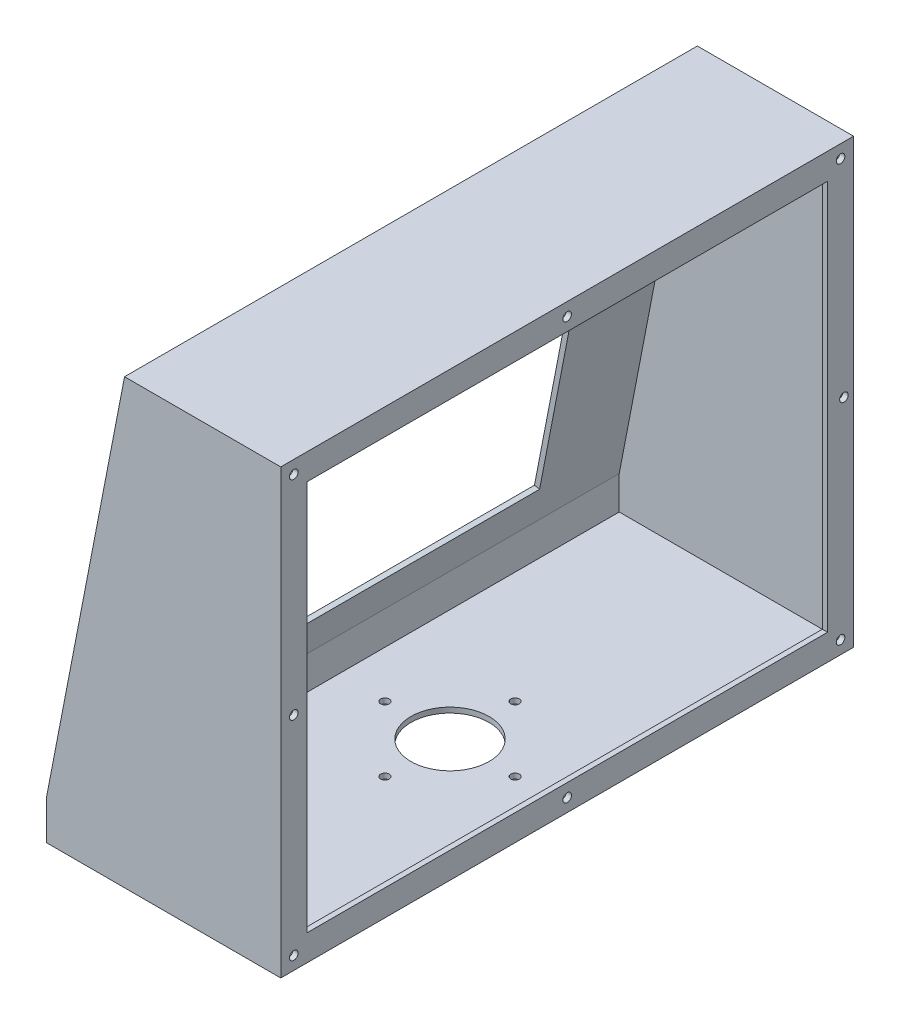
SolidWorks part; units mm, degrees
ref_plane "前基準面" through (0, 0, 0) normal (0, 0, 1) x (1, 0, 0)
ref_plane "上基準面" through (0, 0, 0) normal (0, 1, 0) x (1, 0, 0)
ref_plane "右基準面" through (0, 0, 0) normal (1, 0, 0) x (0, 0, -1)
sketch "草圖1" plane through (0, 0, 0) normal (0, 0, 1) x (1, 0, 0)
  line L0 (0, 0) -> (-30, -155)
  line L1 (-30, -155) -> (-30, -170)
  line L2 (-30, -170) -> (60, -170)
  line L3 (60, -170) -> (60, 0)
  line L4 (60, 0) -> (0, 0)
  dimension "D1" = 170
  dimension "D2" = 90
  dimension "D3" = 60
  dimension "D4" = 15
extrude "填料-伸長1" add sketch "草圖1" along normal blind 220
sketch "草圖3" plane through (60, 0, 0) normal (1, 0, 0) x (0, 0, -1)
  line L0 (-220, -170) -> (-220, 0) construction
  line L1 (-210, -10) -> (-10, -10)
  line L2 (-210, -10) -> (-210, -160)
  line L3 (-210, -160) -> (-10, -160)
  line L4 (-10, -10) -> (-10, -160)
  line L5 (-220, -170) -> (0, -170) construction
  dimension "D1" = 200
  dimension "D2" = 10
  dimension "D3" = 150
  dimension "D4" = 10
extrude "除料-伸長3" cut sketch "草圖3" against normal blind 60
shell "薄殼2" thickness 2
sketch "草圖4" plane through (1.9636, -0.38, 0) normal (0.9818, -0.19, 0) x (0, 0, -1)
  line L1 (0, 0) -> (0, -157.8765) construction
  line L2 (-35, -20) -> (-192, -20)
  line L3 (-35, -20) -> (-35, -145)
  line L4 (-35, -145) -> (-192, -145)
  line L6 (-192, -20) -> (-192, -145)
  line L7 (-220, 0) -> (0, 0) construction
  dimension "D1" = 157
  dimension "D2" = 125
  dimension "D3" = 35
  dimension "D4" = 20
extrude "除料-伸長6" cut sketch "草圖4" against normal up to next
sketch "草圖5" plane through (1.9636, -0.38, 0) normal (0.9818, -0.19, 0) x (0, 0, -1)
  line L8 (-35, -20) -> (-35, -145) construction
  line L9 (-220, 0) -> (0, 0) construction
  circle A0 centre (-15, -30) radius 8
  dimension "D1" = 16
  dimension "D2" = 20
  dimension "D3" = 30
extrude "除料-伸長7" cut sketch "草圖5" against normal up to next
sketch "草圖6" plane through (0, -170, 0) normal (0, -1, 0) x (1, 0, 0)
  line L0 (-30, 220) -> (60, 220) construction
  line L1 (60, 220) -> (60, 0) construction
  circle A0 centre (15, 110) radius 15
  dimension "D1" = 30
  dimension "D2" = 110
  dimension "D3" = 45
extrude "除料-伸長8" cut sketch "草圖6" against normal blind 2
hole_wizard "M4 螺紋孔1" positions "草圖8" profile "草圖7" tap size "M4" standard "IS"
sketch "草圖8" plane through (0, -168, 0) normal (0, 1, 0) x (-1, 0, 0)
  circle A0 centre (-15, 110) radius 15 construction
  point P0 (10, 110)
  point P1 (-15, 135)
  point P3 (-15, 85)
  point P5 (-40, 110)
  dimension "D1" = 25
  dimension "D2" = 25
  dimension "D3" = 25
  dimension "D4" = 25
sketch "草圖7" plane through (-10, -168, 110) normal (1, 0, 0) x (0, 0, 1)
  line L0 (0, 0) -> (0, 11.0914)
  line L1 (0, 11.0914) -> (1.65, 10.1)
  line L2 (1.65, 10.1) -> (1.65, 0)
  line L5 (1.65, 0) -> (0, 0)
  line L10 (0, 11.0914) -> (-1.65, 10.1) construction
  line L11 (0, -6.35) -> (0, 107.95) construction
  dimension "螺孔鑽直徑" = 3.3
  dimension "螺孔鑽深度" = 10.1
  dimension "導頭角度" = 118
hole_wizard "M4 螺紋孔2" positions "草圖10" profile "草圖9" tap size "M4" standard "IS"
sketch "草圖10" plane through (60, 0, 0) normal (1, 0, 0) x (0, 0, -1)
  line L0 (-220, 0) -> (0, 0) construction
  line L1 (-220, -170) -> (-220, 0) construction
  line L3 (-220, -170) -> (0, -170) construction
  point P0 (-215, -5)
  point P1 (-215, -85)
  point P3 (-215, -165)
  point P5 (-110, -165)
  point P7 (-5, -165)
  point P9 (-3.6939, -85)
  point P11 (-5, -5)
  point P13 (-110, -5)
  dimension "D1" = 80
  dimension "D2" = 80
  dimension "D3" = 5
  dimension "D4" = 5
  dimension "D5" = 105
  dimension "D6" = 5
  dimension "D7" = 105
  dimension "D8" = 5
  dimension "D9" = 80
  dimension "D10" = 80
  dimension "D11" = 105
  dimension "D12" = 5
  dimension "D13" = 105
sketch "草圖9" plane through (60, -5, 215) normal (0, 1, 0) x (0, 0, -1)
  line L0 (0, 0) -> (0, 11.0914)
  line L1 (0, 11.0914) -> (1.65, 10.1)
  line L2 (1.65, 10.1) -> (1.65, 0)
  line L5 (1.65, 0) -> (0, 0)
  line L10 (0, 11.0914) -> (-1.65, 10.1) construction
  line L11 (0, -6.35) -> (0, 107.95) construction
  dimension "螺孔鑽直徑" = 3.3
  dimension "螺孔鑽深度" = 10.1
  dimension "導頭角度" = 118
